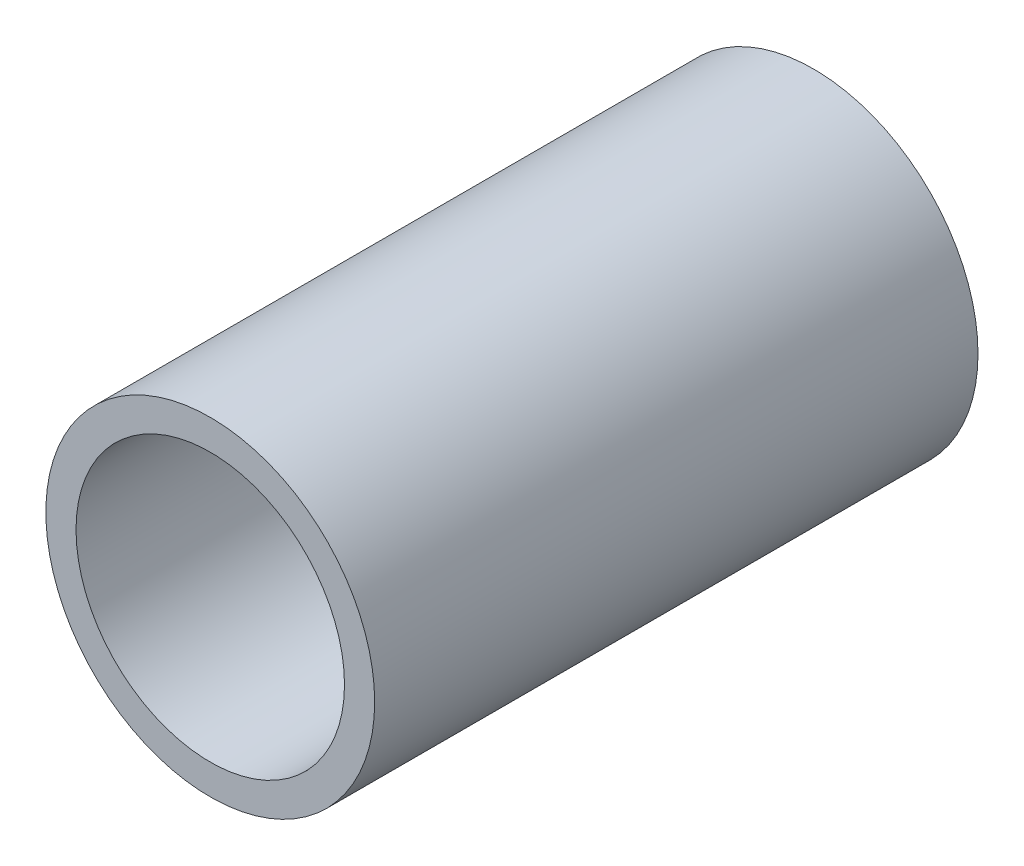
SolidWorks part; units mm, degrees
ref_plane "Front Plane" through (0, 0, 0) normal (0, 0, 1) x (1, 0, 0)
ref_plane "Top Plane" through (0, 0, 0) normal (0, 1, 0) x (1, 0, 0)
ref_plane "Right Plane" through (0, 0, 0) normal (1, 0, 0) x (0, 0, -1)
sketch "Sketch1" plane through (0, 0, 0) normal (0, 0, 1) x (1, 0, 0)
  circle A0 centre (0, 0) radius 28.2575
  circle A1 centre (0, 0) radius 34.6075
  dimension "D1" = 56.515
  dimension "D2" = 69.215
extrude "Boss-Extrude1" add sketch "Sketch1" along normal blind 127
